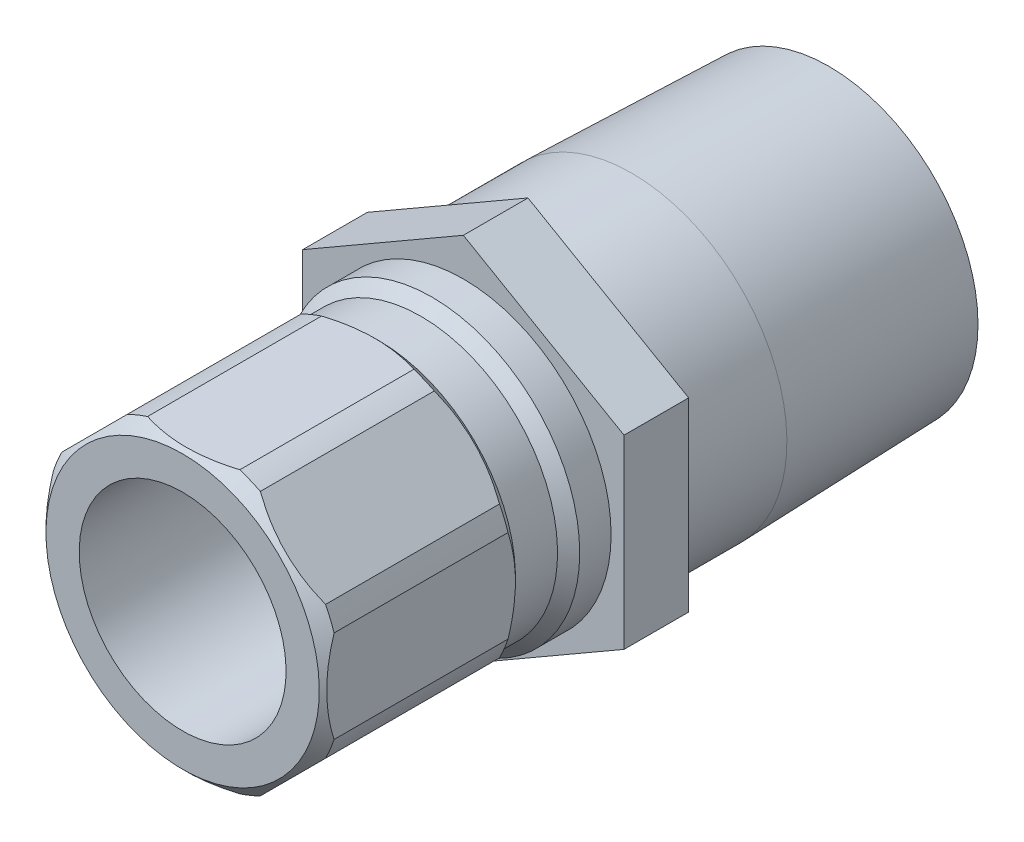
SolidWorks part; units mm, degrees
ref_plane "Front Plane" through (0, 0, 0) normal (0, 0, 1) x (1, 0, 0)
ref_plane "Top Plane" through (0, 0, 0) normal (0, 1, 0) x (1, 0, 0)
ref_plane "Right Plane" through (0, 0, 0) normal (1, 0, 0) x (0, 0, -1)
sketch "Sketch1" plane through (0, 0, 0) normal (1, 0, 0) x (0, 0, -1)
  line L0 (0, 0) -> (-22.479, 0) construction
  line L1 (-19.304, 7.112) -> (-19.304, 9.398)
  line L2 (-5.8166, 9.398) -> (-5.8166, 0) construction
  line L3 (-18.542, 10.16) -> (-6.5786, 10.16)
  line L4 (0, 10.668) -> (0, 0) construction
  line L5 (-5.8166, 9.398) -> (-2.921, 9.398)
  line L6 (-2.159, 10.16) -> (0, 10.16)
  line L7 (0, 10.16) -> (0, 10.668)
  line L8 (-5.8166, 9.398) -> (-6.5786, 10.16)
  line L9 (-2.921, 9.398) -> (-2.159, 10.16)
  line L10 (-19.304, 9.398) -> (-18.542, 10.16)
  line L11 (-1.1053, 7.8994) -> (25.146, 7.8994)
  line L12 (0, 10.668) -> (11.5824, 10.668)
  line L13 (11.5824, 10.668) -> (25.146, 10.2441)
  line L14 (25.146, 10.2441) -> (25.146, 7.8994)
  line L15 (4.445, 0) -> (0, 0) construction
  line L16 (-19.304, 7.112) -> (-1.524, 7.112)
  line L17 (-1.524, 7.112) -> (-1.1053, 7.8994)
  dimension "D1" = 19.304
  dimension "D2" = 2.8956
  dimension "D3" = 0.762
  dimension "D4" = 45
  dimension "D5" = 13.4874
  dimension "D6" = 45
  dimension "D7" = 1.79
  dimension "D8" = 13.5636
  dimension "D9" = 44.45
  dimension "D10" = 3.175
  dimension "D11" = 4.445
  dimension "D12" = 15.7988
  dimension "D13" = 21.336
  dimension "D14" = 20.32
  dimension "D15" = 118
  dimension "D16" = 14.224
  dimension "D17" = 17.78
revolve "Revolve1" add sketch "Sketch1" angle 360 about L0
sketch "Sketch2" plane through (0, 0, 0) normal (0, 0, 1) x (1, 0, 0)
  line L1 (-11.049, 6.3791) -> (-11.049, -6.3791)
  line L2 (-11.049, -6.3791) -> (0, -12.7583)
  line L3 (0, -12.7583) -> (11.049, -6.3791)
  line L4 (11.049, -6.3791) -> (11.049, 6.3791)
  line L5 (11.049, 6.3791) -> (0, 12.7583)
  line L6 (0, 12.7583) -> (-11.049, 6.3791)
  circle A0 centre (0, 0) radius 11.049 construction
  circle A1 centre (0, 0) radius 7.8994 construction
  circle A2 centre (0, 0) radius 7.8994
  dimension "D1" = 22.098
extrude "Boss-Extrude1" add sketch "Sketch2" against normal up to vertex (4.445 mm away)
sketch "Sketch3" plane through (0, 0, 0) normal (0, 0, 1) x (1, 0, 0)
  line L1 (9.652, -3.998) -> (9.652, 3.998)
  line L2 (9.652, 3.998) -> (3.998, 9.652)
  line L3 (3.998, 9.652) -> (-3.998, 9.652)
  line L4 (-3.998, 9.652) -> (-9.652, 3.998)
  line L5 (-9.652, 3.998) -> (-9.652, -3.998)
  line L6 (-9.652, -3.998) -> (-3.998, -9.652)
  line L7 (-3.998, -9.652) -> (3.998, -9.652)
  line L8 (3.998, -9.652) -> (9.652, -3.998)
  circle A0 centre (0, 0) radius 9.652 construction
  dimension "D1" = 19.304
extrude "Cut-Extrude1" cut sketch "Sketch3" along normal through all from vertex at 5.8166 flip side to cut
